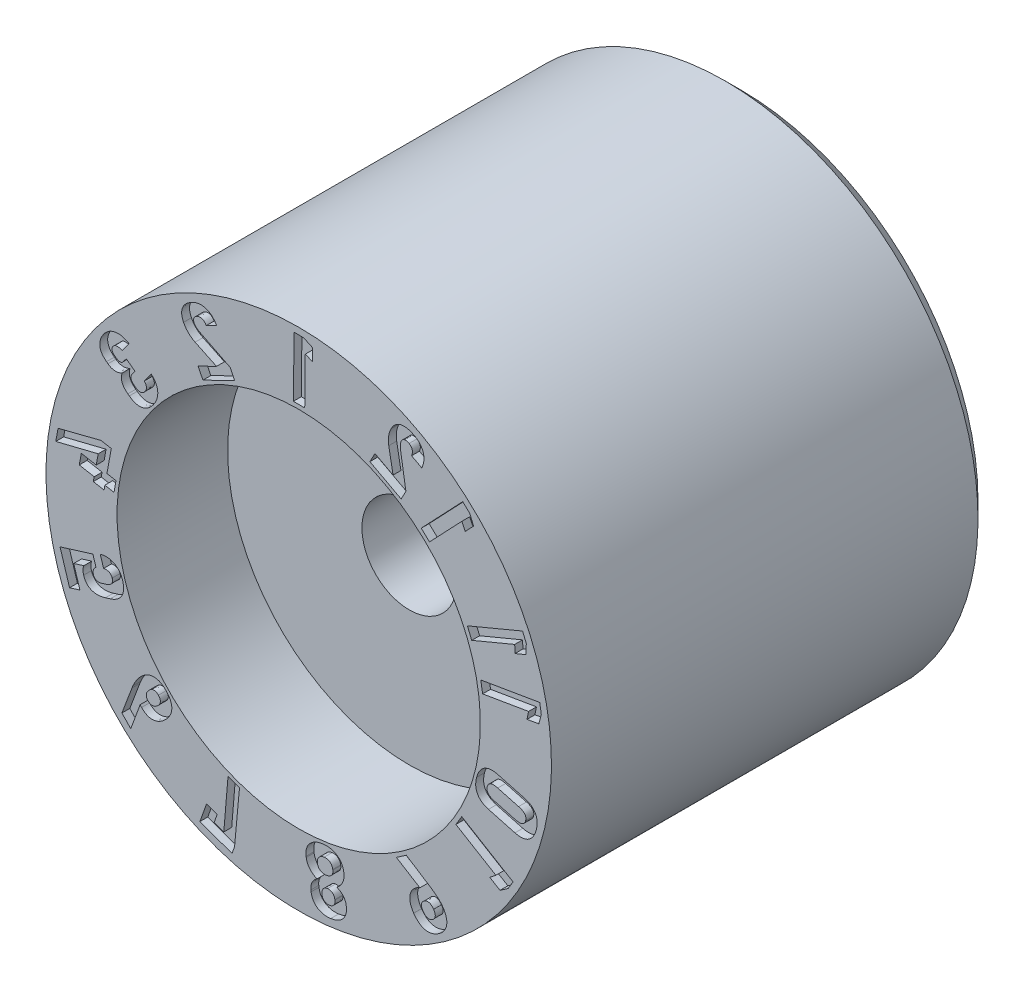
SolidWorks part; units mm, degrees
ref_plane "Front Plane" through (0, 0, 0) normal (0, 0, 1) x (1, 0, 0)
ref_plane "Top Plane" through (0, 0, 0) normal (0, 1, 0) x (1, 0, 0)
ref_plane "Right Plane" through (0, 0, 0) normal (1, 0, 0) x (0, 0, -1)
sketch "Sketch1" plane through (0, 0, 0) normal (-1, 0, 0) x (0, 0, 1)
  line L0 (0, 0) -> (75.4695, 0) construction
  line L2 (-14, -1.5) -> (-14, -7.5)
  line L4 (-13.5, -8) -> (0, -8)
  line L5 (0, -8) -> (0, -5.75)
  line L7 (0, -5.75) -> (-3.5, -5.75)
  line L8 (-3.5, -5.75) -> (-3.5, -1.5)
  line L9 (-3.5, -1.5) -> (-14, -1.5)
  line L12 (-14, -7.5) -> (-13.5, -8)
  point P6 (-14, -8)
  dimension "D1" = 14
  dimension "D2" = 16
  dimension "D3" = 11.5
  dimension "D4" = 3.5
  dimension "D5" = 3
revolve "Revolve1" add sketch "Sketch1" angle 360 about L0
sketch "Sketch2" plane through (0, 0, 0) normal (0, 0, 1) x (0, -1, 0)
  line L0 (-5.8852, -0.1684) -> (-5.8813, 0.1904)
  line L1 (-5.8813, 0.1904) -> (-7.3649, 0.207)
  line L2 (-7.3649, 0.207) -> (-7.2741, 0.4382)
  line L3 (-7.2741, 0.4382) -> (-7.6558, 0.4425)
  line L4 (-7.6558, 0.4425) -> (-7.7871, 0.1594)
  line L5 (-7.7871, 0.1594) -> (-7.7904, -0.1469)
  line L6 (-7.7904, -0.1469) -> (-5.8852, -0.1684)
  line L7 (-5.8129, -2.1676) -> (-6.2953, -3.126)
  line L8 (-6.4615, -3.3102) -> (-6.4641, -3.3111)
  line L9 (-6.5834, -2.9245) -> (-6.5824, -2.9238)
  line L10 (-6.5824, -2.9238) -> (-6.743, -2.5953)
  line L11 (-6.743, -2.5953) -> (-6.744, -2.596)
  line L12 (-6.3122, -3.6457) -> (-6.3112, -3.645)
  line L13 (-5.9497, -3.2788) -> (-5.6256, -2.6016)
  line L14 (-5.6256, -2.6016) -> (-5.3417, -3.1833)
  line L15 (-5.3417, -3.1833) -> (-5.0327, -3.0325)
  line L16 (-5.0327, -3.0325) -> (-5.524, -2.0266)
  line L17 (-5.524, -2.0266) -> (-5.8129, -2.1676)
  line L18 (-4.3769, -4.6673) -> (-4.0799, -4.8894)
  line L19 (-3.7679, -5.1641) -> (-3.7944, -5.1997)
  line L20 (-4.0701, -5.2769) -> (-4.1992, -5.1804)
  line L21 (-4.1992, -5.1804) -> (-4.4066, -5.4574)
  line L22 (-4.4066, -5.4574) -> (-4.2775, -5.5539)
  line L23 (-4.2807, -5.7973) -> (-4.3001, -5.8233)
  line L24 (-4.5665, -5.5903) -> (-4.8624, -5.369)
  line L25 (-4.0138, -6.0834) -> (-3.9793, -6.0372)
  line L26 (-3.4699, -5.4087) -> (-3.4353, -5.3625)
  line L27 (-1.7674, -6.2554) -> (-1.4221, -7.6169)
  line L28 (-1.4221, -7.6169) -> (-1.0242, -7.6897)
  line L29 (-1.0242, -7.6897) -> (-1.3566, -6.3465)
  line L30 (-1.3566, -6.3465) -> (-1.0162, -6.4089)
  line L31 (-0.5183, -6.5003) -> (-0.456, -6.1616)
  line L32 (-0.456, -6.1616) -> (-0.6022, -6.1348)
  line L33 (-1.708, -5.9321) -> (-1.7674, -6.2554)
  line L34 (-1.1029, -6.8816) -> (-0.7511, -6.9461)
  line L35 (-0.7511, -6.9461) -> (-0.6644, -6.4735)
  line L36 (-0.5494, -5.847) -> (-0.9012, -5.7826)
  line L37 (-0.9012, -5.7826) -> (-0.954, -6.0703)
  line L38 (1.3595, -6.2809) -> (1.3599, -6.2821)
  line L39 (1.3599, -6.2821) -> (1.7008, -6.1764)
  line L40 (1.7008, -6.1764) -> (1.7004, -6.1753)
  line L41 (2.0865, -6.0701) -> (2.1334, -6.2219)
  line L42 (1.794, -6.4162) -> (1.4756, -6.5149)
  line L43 (1.4756, -6.5149) -> (1.7978, -7.5544)
  line L44 (1.7978, -7.5544) -> (2.7693, -7.2535)
  line L45 (2.7693, -7.2535) -> (2.6674, -6.9253)
  line L46 (2.6674, -6.9253) -> (2.0368, -7.1206)
  line L47 (2.0368, -7.1206) -> (1.938, -6.8008)
  line L48 (2.4744, -6.1166) -> (2.4275, -5.9647)
  line L49 (4.0672, -4.99) -> (4.068, -4.9907)
  line L50 (4.528, -5.2774) -> (5.3733, -5.5969)
  line L51 (5.3733, -5.5969) -> (5.6639, -5.3158)
  line L52 (5.6639, -5.3158) -> (4.8545, -5.0182)
  line L54 (4.8709, -4.2237) -> (4.8697, -4.2225)
  line L55 (4.5971, -4.4553) -> (4.5983, -4.4565)
  line L56 (4.313, -4.7302) -> (4.3122, -4.7294)
  line L57 (7.2565, -2.031) -> (5.5551, -1.8735)
  line L58 (5.5551, -1.8735) -> (5.4252, -2.2375)
  line L59 (5.4252, -2.2375) -> (7.0216, -2.3711)
  line L60 (7.0216, -2.3711) -> (6.9122, -2.6771)
  line L61 (6.9122, -2.6771) -> (6.6439, -2.5811)
  line L62 (6.6439, -2.5811) -> (6.5241, -2.917)
  line L63 (6.5241, -2.917) -> (7.116, -3.1286)
  line L64 (7.116, -3.1286) -> (7.4797, -2.1106)
  line L65 (7.4797, -2.1106) -> (7.2565, -2.031)
  line L66 (6.3837, 0.2337) -> (6.4146, 0.2376)
  line L67 (7.2319, 0.385) -> (7.2812, 0.3913)
  line L68 (7.1342, 1.5064) -> (7.0849, 1.5001)
  line L69 (6.2572, 1.4299) -> (6.2263, 1.426)
  line L70 (6.3248, 1.0781) -> (6.3427, 1.0807)
  line L71 (6.4052, 0.5969) -> (6.3856, 0.5946)
  line L72 (7.1171, 1.1433) -> (7.1354, 1.146)
  line L73 (7.1874, 0.7395) -> (7.1682, 0.7373)
  line L75 (6.2418, 3.6387) -> (6.2433, 3.6395)
  line L76 (5.6038, 4.5563) -> (5.6023, 4.5556)
  line L77 (5.251, 4.1507) -> (4.7713, 3.4049)
  line L78 (4.7713, 3.4049) -> (4.9874, 3.0914)
  line L79 (4.9874, 3.0914) -> (5.4482, 3.8353)
  line L80 (5.8208, 4.2686) -> (5.8219, 4.2694)
  line L81 (6.0466, 3.941) -> (6.0455, 3.9401)
  line L82 (2.8354, 5.1597) -> (3.1417, 4.9756)
  line L83 (3.1417, 4.9756) -> (3.9023, 6.2398)
  line L84 (3.9023, 6.2398) -> (4.0547, 6.0458)
  line L85 (4.0547, 6.0458) -> (4.2501, 6.371)
  line L86 (4.2501, 6.371) -> (4.0738, 6.626)
  line L87 (4.0738, 6.626) -> (3.8125, 6.7833)
  line L88 (3.8125, 6.7833) -> (2.8354, 5.1597)
  line L89 (2.2124, 6.0064) -> (2.4386, 6.8437)
  line L90 (1.3369, 7.1415) -> (1.1107, 6.3043)
  line L91 (1.4817, 6.2993) -> (1.6602, 6.9591)
  line L92 (2.0679, 6.8485) -> (1.8895, 6.1887)
  line L93 (-1.2115, 5.7613) -> (-0.8595, 5.8212)
  line L94 (-0.8595, 5.8212) -> (-1.1058, 7.2741)
  line L95 (-1.1058, 7.2741) -> (-0.8644, 7.2268)
  line L96 (-0.8644, 7.2268) -> (-0.9278, 7.5999)
  line L97 (-0.9278, 7.5999) -> (-1.2279, 7.6789)
  line L98 (-1.2279, 7.6789) -> (-1.5282, 7.6276)
  line L99 (-1.5282, 7.6276) -> (-1.2115, 5.7613)
  line L100 (-2.4833, 5.3383) -> (-2.1544, 5.476)
  line L101 (-2.1544, 5.476) -> (-2.7229, 6.8365)
  line L102 (-2.7229, 6.8365) -> (-2.4763, 6.8448)
  line L103 (-2.4763, 6.8448) -> (-2.6226, 7.1943)
  line L104 (-2.6226, 7.1943) -> (-2.9328, 7.2031)
  line L105 (-2.9328, 7.2031) -> (-3.2138, 7.0855)
  line L106 (-3.2138, 7.0855) -> (-2.4833, 5.3383)
  line L107 (-4.4306, 3.8778) -> (-4.1829, 4.1388)
  line L108 (-4.1829, 4.1388) -> (-5.2607, 5.1622)
  line L109 (-5.2607, 5.1622) -> (-5.0369, 5.2705)
  line L110 (-5.0369, 5.2705) -> (-5.3141, 5.5334)
  line L111 (-5.3141, 5.5334) -> (-5.6036, 5.415)
  line L112 (-5.6036, 5.415) -> (-5.8151, 5.1922)
  line L113 (-5.8151, 5.1922) -> (-4.4306, 3.8778)
  line L114 (-5.1966, 3.3926) -> (-6.2573, 3.2208)
  line L115 (-6.5045, 3.2475) -> (-6.5068, 3.2487)
  line L116 (-6.2632, 3.5728) -> (-6.2623, 3.5721)
  line L117 (-6.2623, 3.5721) -> (-6.0898, 3.8952)
  line L118 (-6.0898, 3.8952) -> (-6.0908, 3.8959)
  line L119 (-6.6889, 2.9293) -> (-6.6876, 2.9288)
  line L120 (-6.1782, 2.8506) -> (-5.4387, 2.9854)
  line L121 (-5.4387, 2.9854) -> (-5.7435, 2.4136)
  line L122 (-5.7435, 2.4136) -> (-5.4397, 2.2518)
  line L123 (-5.4397, 2.2518) -> (-4.9123, 3.2412)
  line L124 (-4.9123, 3.2412) -> (-5.1966, 3.3926)
  line L125 (-1.0162, -6.4089) -> (-1.1029, -6.8816)
  line L126 (-0.6022, -6.1348) -> (-0.5494, -5.847)
  line L127 (-0.6644, -6.4735) -> (-0.5183, -6.5003)
  line L128 (-0.954, -6.0703) -> (-1.708, -5.9321)
  circle A0 centre (0, 0) radius 5.9 construction
  spline S0 degree 3 poles (-6.2953, -3.126) (-6.3152, -3.1668) (-6.3464, -3.2142) (-6.3924, -3.2615) (-6.4218, -3.2867) (-6.4453, -3.302) (-6.4615, -3.3102) knots 0 0 0 0 0.540924 0.666719 0.78521 1 1 1 1
  spline S1 degree 3 poles (-6.4641, -3.3111) (-6.4847, -3.3216) (-6.5178, -3.3314) (-6.5623, -3.3294) (-6.5931, -3.3197) (-6.6217, -3.3023) (-6.6593, -3.269) (-6.6789, -3.2343) (-6.6913, -3.2103) knots 0 0 0 0 0.246374 0.357484 0.468975 0.586096 0.710177 1 1 1 1
  spline S2 degree 3 poles (-6.6913, -3.2103) (-6.7032, -3.186) (-6.7153, -3.1471) (-6.7135, -3.0939) (-6.7028, -3.0558) (-6.6849, -3.019) (-6.6481, -2.971) (-6.6106, -2.9421) (-6.5834, -2.9245) knots 0 0 0 0 0.239492 0.352314 0.467332 0.58681 0.712523 1 1 1 1
  spline S3 degree 3 poles (-6.744, -2.596) (-6.7923, -2.6236) (-6.8595, -2.6705) (-6.9348, -2.7456) (-6.9806, -2.8046) (-7.0174, -2.8669) (-7.0446, -2.9321) (-7.0619, -3) (-7.0694, -3.0701) (-7.0669, -3.1417) (-7.0515, -3.2407) (-7.0234, -3.3123) (-7.0012, -3.359) knots 0 0 0 0 0.185501 0.271338 0.35402 0.434025 0.511907 0.588797 0.66669 0.746156 0.827115 1 1 1 1
  spline S4 degree 3 poles (-7.0012, -3.359) (-6.977, -3.4084) (-6.9364, -3.4779) (-6.8701, -3.5577) (-6.8181, -3.6062) (-6.763, -3.6453) (-6.7054, -3.6758) (-6.6441, -3.6949) (-6.5809, -3.7055) (-6.5153, -3.7055) (-6.4234, -3.6916) (-6.3559, -3.6674) (-6.3122, -3.6457) knots 0 0 0 0 0.19475 0.283309 0.366633 0.445697 0.521961 0.59653 0.67174 0.748345 0.827521 1 1 1 1
  spline S5 degree 3 poles (-6.3112, -3.645) (-6.2724, -3.6266) (-6.2171, -3.5924) (-6.1485, -3.5387) (-6.1004, -3.4929) (-6.0554, -3.4441) (-6.0027, -3.374) (-5.9681, -3.3183) (-5.9497, -3.2788) knots 0 0 0 0 0.245976 0.371149 0.498271 0.62543 0.751106 1 1 1 1
  spline S6 degree 3 poles (-3.5683, -4.6062) (-3.6119, -4.5727) (-3.6815, -4.5314) (-3.779, -4.4903) (-3.8517, -4.4705) (-3.9242, -4.4601) (-3.9959, -4.4598) (-4.0665, -4.4693) (-4.1357, -4.4886) (-4.2023, -4.5183) (-4.2884, -4.5722) (-4.3435, -4.6272) (-4.3769, -4.6673) knots 0 0 0 0 0.181569 0.26678 0.349602 0.430041 0.508529 0.586128 0.665195 0.745151 0.826793 1 1 1 1
  spline S7 degree 3 poles (-4.0799, -4.8894) (-4.0669, -4.8761) (-4.0461, -4.8582) (-4.0157, -4.8394) (-3.9928, -4.8294) (-3.9696, -4.8224) (-3.9462, -4.8188) (-3.9227, -4.8178) (-3.8992, -4.8202) (-3.8758, -4.8259) (-3.8445, -4.8381) (-3.8224, -4.8513) (-3.8084, -4.8619) knots 0 0 0 0 0.185322 0.271186 0.353768 0.433306 0.511129 0.588304 0.666454 0.745868 0.826198 1 1 1 1
  spline S8 degree 3 poles (-3.8084, -4.8619) (-3.7838, -4.8799) (-3.7516, -4.9115) (-3.7246, -4.9627) (-3.7148, -5.002) (-3.7139, -5.0425) (-3.7266, -5.0997) (-3.7494, -5.1392) (-3.7679, -5.1641) knots 0 0 0 0 0.264916 0.382863 0.497044 0.612324 0.730419 1 1 1 1
  spline S9 degree 3 poles (-3.7944, -5.1997) (-3.8143, -5.2251) (-3.8448, -5.2612) (-3.8947, -5.2932) (-3.9304, -5.3084) (-3.9667, -5.3139) (-4.0162, -5.3106) (-4.0498, -5.2915) (-4.0701, -5.2769) knots 0 0 0 0 0.301108 0.428623 0.546089 0.657263 0.765523 1 1 1 1
  spline S10 degree 3 poles (-4.2775, -5.5539) (-4.2606, -5.5659) (-4.2395, -5.5894) (-4.2256, -5.6281) (-4.2227, -5.6593) (-4.2267, -5.6923) (-4.2429, -5.7407) (-4.2637, -5.7751) (-4.2807, -5.7973) knots 0 0 0 0 0.226456 0.333734 0.444659 0.565242 0.694774 1 1 1 1
  spline S11 degree 3 poles (-4.3001, -5.8233) (-4.316, -5.844) (-4.3415, -5.8728) (-4.3832, -5.8977) (-4.4139, -5.9084) (-4.4453, -5.9117) (-4.4886, -5.906) (-4.5184, -5.8898) (-4.5363, -5.8763) knots 0 0 0 0 0.287243 0.411792 0.527495 0.639812 0.753407 1 1 1 1
  spline S12 degree 3 poles (-4.5363, -5.8763) (-4.5486, -5.8667) (-4.5659, -5.8506) (-4.5829, -5.8244) (-4.5928, -5.8032) (-4.6, -5.7804) (-4.6042, -5.7564) (-4.6057, -5.7311) (-4.6037, -5.7045) (-4.599, -5.677) (-4.5879, -5.6382) (-4.5763, -5.6093) (-4.5665, -5.5903) knots 0 0 0 0 0.149751 0.222736 0.297358 0.372558 0.449625 0.529756 0.614461 0.703231 0.795895 1 1 1 1
  spline S13 degree 3 poles (-4.8624, -5.369) (-4.8911, -5.416) (-4.9278, -5.4887) (-4.9572, -5.5906) (-4.9688, -5.6648) (-4.9713, -5.7378) (-4.9635, -5.8089) (-4.947, -5.8776) (-4.9206, -5.9432) (-4.8866, -6.0056) (-4.8283, -6.0834) (-4.7748, -6.1342) (-4.7348, -6.1635) knots 0 0 0 0 0.185347 0.27176 0.355595 0.437386 0.516616 0.59533 0.674074 0.753729 0.833597 1 1 1 1
  spline S14 degree 3 poles (-4.7348, -6.1635) (-4.7029, -6.1875) (-4.6539, -6.2194) (-4.5859, -6.2533) (-4.5367, -6.2726) (-4.4879, -6.2861) (-4.4395, -6.2949) (-4.3914, -6.2974) (-4.344, -6.2952) (-4.2974, -6.2876) (-4.2524, -6.2739) (-4.2085, -6.2558) (-4.1665, -6.2317) (-4.1258, -6.2025) (-4.072, -6.1553) (-4.0365, -6.1132) (-4.0138, -6.0834) knots 0 0 0 0 0.145015 0.212027 0.275759 0.336776 0.395938 0.454132 0.511359 0.568209 0.624973 0.681963 0.740474 0.800697 0.863707 1 1 1 1
  spline S15 degree 3 poles (-3.9793, -6.0372) (-3.9543, -6.0039) (-3.9232, -5.9499) (-3.9007, -5.8716) (-3.8929, -5.8127) (-3.895, -5.7534) (-3.911, -5.6733) (-3.9367, -5.6164) (-3.9588, -5.5808) knots 0 0 0 0 0.256338 0.378395 0.499234 0.620463 0.74196 1 1 1 1
  spline S16 degree 3 poles (-3.9588, -5.5808) (-3.9382, -5.5906) (-3.9061, -5.6014) (-3.8624, -5.61) (-3.8302, -5.6136) (-3.798, -5.613) (-3.7657, -5.6098) (-3.7335, -5.6033) (-3.6905, -5.5903) (-3.6377, -5.5656) (-3.554, -5.5098) (-3.5024, -5.4506) (-3.4699, -5.4087) knots 0 0 0 0 0.120784 0.179432 0.236283 0.292935 0.350396 0.408362 0.467375 0.589077 0.716316 1 1 1 1
  spline S17 degree 3 poles (-3.4353, -5.3625) (-3.4049, -5.3206) (-3.3638, -5.2562) (-3.33, -5.1633) (-3.3155, -5.0959) (-3.3116, -5.0291) (-3.3173, -4.9631) (-3.3344, -4.8983) (-3.3615, -4.8349) (-3.3986, -4.7733) (-3.4642, -4.6926) (-3.524, -4.6388) (-3.5683, -4.6062) knots 0 0 0 0 0.178322 0.259914 0.338341 0.414267 0.48915 0.565077 0.643479 0.725106 0.811155 1 1 1 1
  spline S18 degree 3 poles (1.722, -5.5757) (1.6758, -5.5903) (1.6088, -5.6185) (1.5303, -5.6726) (1.4787, -5.7194) (1.4342, -5.7722) (1.398, -5.8314) (1.3689, -5.8956) (1.3491, -5.9654) (1.338, -6.0395) (1.3351, -6.1459) (1.3469, -6.2269) (1.3595, -6.2809) knots 0 0 0 0 0.164951 0.244387 0.322686 0.400848 0.478265 0.557501 0.639295 0.723925 0.811483 1 1 1 1
  spline S19 degree 3 poles (1.7004, -6.1753) (1.6936, -6.1442) (1.6897, -6.0981) (1.698, -6.0392) (1.7117, -6.0012) (1.7318, -5.9677) (1.7686, -5.9304) (1.804, -5.9118) (1.8296, -5.9044) knots 0 0 0 0 0.286251 0.41197 0.532179 0.648041 0.760757 1 1 1 1
  spline S20 degree 3 poles (1.8296, -5.9044) (1.8566, -5.8959) (1.8985, -5.8899) (1.952, -5.9014) (1.9873, -5.9194) (2.0189, -5.9456) (2.058, -5.9933) (2.0762, -6.0385) (2.0865, -6.0701) knots 0 0 0 0 0.245943 0.357035 0.469046 0.586207 0.710397 1 1 1 1
  spline S21 degree 3 poles (2.1334, -6.2219) (2.1432, -6.2536) (2.1536, -6.3007) (2.1512, -6.3615) (2.1417, -6.4001) (2.1255, -6.4339) (2.0928, -6.4717) (2.0589, -6.4897) (2.0346, -6.4968) knots 0 0 0 0 0.302868 0.431901 0.550443 0.661671 0.769584 1 1 1 1
  spline S22 degree 3 poles (2.0346, -6.4968) (2.0117, -6.5037) (1.9767, -6.5104) (1.9303, -6.5068) (1.8978, -6.499) (1.8675, -6.4857) (1.8299, -6.4608) (1.8066, -6.4354) (1.794, -6.4162) knots 0 0 0 0 0.262338 0.385718 0.507592 0.627408 0.74745 1 1 1 1
  spline S23 degree 3 poles (1.938, -6.8008) (1.9557, -6.8093) (1.9848, -6.8195) (2.0268, -6.8258) (2.0615, -6.828) (2.0973, -6.8268) (2.1443, -6.8229) (2.1785, -6.8148) (2.2005, -6.8082) knots 0 0 0 0 0.220181 0.34169 0.473688 0.609114 0.742087 1 1 1 1
  spline S24 degree 3 poles (2.2005, -6.8082) (2.2442, -6.7944) (2.307, -6.7679) (2.378, -6.715) (2.4221, -6.67) (2.4586, -6.619) (2.4865, -6.562) (2.5057, -6.4993) (2.5165, -6.4314) (2.5186, -6.3587) (2.511, -6.2518) (2.4909, -6.1711) (2.4744, -6.1166) knots 0 0 0 0 0.163581 0.239383 0.313638 0.387163 0.461531 0.538643 0.619556 0.705725 0.79695 1 1 1 1
  spline S25 degree 3 poles (2.4275, -5.9647) (2.4107, -5.9103) (2.3795, -5.8326) (2.3216, -5.7412) (2.2735, -5.6839) (2.2202, -5.6357) (2.1617, -5.597) (2.0982, -5.5685) (2.0302, -5.5495) (1.9578, -5.5406) (1.8534, -5.5424) (1.7744, -5.5593) (1.722, -5.5757) knots 0 0 0 0 0.186924 0.272225 0.353505 0.431383 0.507079 0.582002 0.658711 0.737653 0.81986 1 1 1 1
  spline S26 degree 3 poles (4.0675, -4.1929) (4.0284, -4.2308) (3.976, -4.2913) (3.924, -4.3809) (3.8974, -4.448) (3.8809, -4.5161) (3.8757, -4.585) (3.8811, -4.6541) (3.897, -4.7234) (3.924, -4.7921) (3.9757, -4.8855) (4.0278, -4.9496) (4.0672, -4.99) knots 0 0 0 0 0.180435 0.26266 0.341945 0.418745 0.493877 0.569633 0.647322 0.728297 0.813161 1 1 1 1
  spline S27 degree 3 poles (4.068, -4.9907) (4.0926, -5.0161) (4.1326, -5.0524) (4.1904, -5.0976) (4.288, -5.1652) (4.3765, -5.2129) (4.4503, -5.2456) knots 0 0 0 0 0.229425 0.350331 0.475684 1 1 1 1
  spline S28 degree 3 poles (4.4503, -5.2456) (4.4634, -5.2511) (4.4888, -5.263) (4.5151, -5.2728) (4.528, -5.2774) knots 0 0 0 0 0.507579 1 1 1 1
  spline S29 degree 3 poles (4.8545, -5.0182) (4.8741, -5.0056) (4.8922, -4.9908) (4.9089, -4.9746) knots 0.758085 0.758085 0.758085 0.758085 1 1 1 1
  spline S30 degree 3 poles (4.9089, -4.9746) (4.9442, -4.9409) (4.9898, -4.8856) (5.0347, -4.8038) (5.0562, -4.7417) (5.0686, -4.6781) (5.0697, -4.6135) (5.0613, -4.5481) (5.0425, -4.4824) (5.0142, -4.4164) (4.9617, -4.3257) (4.9092, -4.2638) (4.8709, -4.2237) knots 0 0 0 0 0.171552 0.250176 0.326702 0.401809 0.476743 0.552956 0.632633 0.716301 0.80484 1 1 1 1
  spline S31 degree 3 poles (4.8697, -4.2225) (4.8307, -4.1811) (4.7674, -4.1271) (4.6753, -4.0712) (4.6066, -4.0419) (4.5374, -4.0227) (4.4679, -4.0147) (4.3985, -4.017) (4.3295, -4.0314) (4.2614, -4.0558) (4.1694, -4.1043) (4.1069, -4.1549) (4.0675, -4.1929) knots 0 0 0 0 0.18695 0.271963 0.353439 0.431722 0.507098 0.582642 0.658968 0.737738 0.81972 1 1 1 1
  spline S32 degree 3 poles (4.3071, -4.4406) (4.3273, -4.4203) (4.3616, -4.3958) (4.4132, -4.3792) (4.4513, -4.3771) (4.4895, -4.3836) (4.5421, -4.4047) (4.576, -4.4338) (4.5971, -4.4553) knots 0 0 0 0 0.260089 0.374783 0.488634 0.603178 0.72406 1 1 1 1
  spline S33 degree 3 poles (4.5983, -4.4565) (4.6224, -4.4816) (4.6545, -4.5208) (4.6793, -4.5798) (4.688, -4.6211) (4.6869, -4.6617) (4.672, -4.7153) (4.6455, -4.7496) (4.6251, -4.7696) knots 0 0 0 0 0.294173 0.419085 0.536109 0.647083 0.757101 1 1 1 1
  spline S34 degree 3 poles (4.6251, -4.7696) (4.6047, -4.7891) (4.5697, -4.8142) (4.5155, -4.8264) (4.4746, -4.8261) (4.4334, -4.8155) (4.3753, -4.7882) (4.3374, -4.7547) (4.313, -4.7302) knots 0 0 0 0 0.239607 0.350713 0.462757 0.580918 0.706868 1 1 1 1
  spline S35 degree 3 poles (4.3122, -4.7294) (4.2916, -4.7073) (4.2635, -4.6726) (4.2441, -4.6194) (4.2387, -4.5813) (4.2428, -4.5435) (4.2606, -4.4928) (4.2868, -4.4601) (4.3071, -4.4406) knots 0 0 0 0 0.27769 0.398449 0.513506 0.626362 0.741961 1 1 1 1
  spline S36 degree 3 poles (5.7823, 0.7607) (5.7894, 0.7045) (5.8077, 0.623) (5.8491, 0.5224) (5.8865, 0.4557) (5.9305, 0.3963) (5.9809, 0.3455) (6.0369, 0.3028) (6.0986, 0.2695) (6.1646, 0.2449) (6.26, 0.2259) (6.3342, 0.2272) (6.3837, 0.2337) knots 0 0 0 0 0.18897 0.276572 0.3617 0.443462 0.521959 0.59953 0.67713 0.754933 0.833533 1 1 1 1
  spline S37 degree 3 poles (6.4146, 0.2376) (6.461, 0.2429) (6.5286, 0.2631) (6.6125, 0.3064) (6.6706, 0.3488) (6.7232, 0.3979) (6.7821, 0.473) (6.815, 0.5366) (6.8295, 0.5819) knots 0 0 0 0 0.245874 0.369723 0.497261 0.62485 0.749381 1 1 1 1
  spline S38 degree 3 poles (6.8295, 0.5819) (6.8516, 0.548) (6.8917, 0.5021) (6.9556, 0.4529) (7.0076, 0.4228) (7.0621, 0.3998) (7.1369, 0.3815) (7.1943, 0.3794) (7.2319, 0.385) knots 0 0 0 0 0.257462 0.383888 0.511837 0.638239 0.759243 1 1 1 1
  spline S39 degree 3 poles (7.2812, 0.3913) (7.3279, 0.397) (7.3955, 0.4147) (7.4778, 0.4551) (7.5322, 0.4932) (7.58, 0.5388) (7.6213, 0.5907) (7.6544, 0.6494) (7.6806, 0.7135) (7.6989, 0.7828) (7.7115, 0.8836) (7.7088, 0.9616) (7.7015, 1.0142) knots 0 0 0 0 0.16692 0.245622 0.324152 0.401797 0.479414 0.558535 0.640111 0.724597 0.811872 1 1 1 1
  spline S40 degree 3 poles (7.7015, 1.0142) (7.694, 1.0664) (7.678, 1.143) (7.6384, 1.2365) (7.6035, 1.2991) (7.5612, 1.354) (7.5141, 1.4019) (7.461, 1.4413) (7.4032, 1.4727) (7.3405, 1.4951) (7.2508, 1.5141) (7.1807, 1.5124) (7.1342, 1.5064) knots 0 0 0 0 0.18794 0.275344 0.360031 0.441653 0.520786 0.597734 0.675552 0.75395 0.83321 1 1 1 1
  spline S41 degree 3 poles (7.0849, 1.5001) (7.0468, 1.4953) (6.9911, 1.4785) (6.9231, 1.4408) (6.8766, 1.4035) (6.8339, 1.3609) (6.7861, 1.2953) (6.7596, 1.2402) (6.7478, 1.2011) knots 0 0 0 0 0.242029 0.363319 0.489116 0.616671 0.742842 1 1 1 1
  spline S42 degree 3 poles (6.7478, 1.2011) (6.7206, 1.2404) (6.6739, 1.2959) (6.596, 1.3522) (6.5329, 1.3874) (6.4657, 1.4131) (6.3741, 1.4358) (6.3032, 1.4354) (6.2572, 1.4299) knots 0 0 0 0 0.252401 0.377134 0.504621 0.631739 0.755354 1 1 1 1
  spline S43 degree 3 poles (6.2263, 1.426) (6.1768, 1.4196) (6.105, 1.401) (6.0177, 1.3581) (5.9605, 1.3171) (5.9094, 1.2692) (5.8665, 1.2136) (5.8311, 1.1512) (5.8041, 1.0825) (5.7849, 1.0083) (5.7708, 0.9005) (5.7754, 0.817) (5.7823, 0.7607) knots 0 0 0 0 0.166281 0.24502 0.322997 0.400172 0.477621 0.5562 0.638393 0.723135 0.810892 1 1 1 1
  spline S44 degree 3 poles (6.1239, 0.8059) (6.1205, 0.8284) (6.1201, 0.8621) (6.1269, 0.9056) (6.1359, 0.9358) (6.1481, 0.9641) (6.1647, 0.9895) (6.1843, 1.0124) (6.2072, 1.0325) (6.2331, 1.0493) (6.2713, 1.0683) (6.3032, 1.0749) (6.3248, 1.0781) knots 0 0 0 0 0.179137 0.263849 0.346611 0.427375 0.506262 0.584852 0.66468 0.745956 0.827181 1 1 1 1
  spline S45 degree 3 poles (6.3427, 1.0807) (6.3628, 1.084) (6.3929, 1.0834) (6.4317, 1.0759) (6.4583, 1.0654) (6.4834, 1.0521) (6.5057, 1.0344) (6.5265, 1.0142) (6.5443, 0.9902) (6.5595, 0.9633) (6.5767, 0.9228) (6.5836, 0.8896) (6.5869, 0.867) knots 0 0 0 0 0.166691 0.246113 0.323892 0.401265 0.478433 0.557271 0.639209 0.723761 0.811153 1 1 1 1
  spline S46 degree 3 poles (6.5869, 0.867) (6.5898, 0.8443) (6.5914, 0.8105) (6.5857, 0.7669) (6.5779, 0.7368) (6.5665, 0.7091) (6.5522, 0.6837) (6.5344, 0.6611) (6.5136, 0.6413) (6.49, 0.6245) (6.4544, 0.6071) (6.4253, 0.5993) (6.4052, 0.5969) knots 0 0 0 0 0.18743 0.275451 0.359684 0.44151 0.520155 0.597919 0.676479 0.755124 0.834279 1 1 1 1
  spline S47 degree 3 poles (6.3856, 0.5946) (6.364, 0.5911) (6.3318, 0.5914) (6.29, 0.5981) (6.2611, 0.608) (6.2342, 0.6219) (6.2094, 0.6386) (6.1875, 0.6593) (6.1682, 0.6832) (6.1523, 0.7103) (6.134, 0.7504) (6.1269, 0.7835) (6.1239, 0.8059) knots 0 0 0 0 0.172867 0.253862 0.334268 0.413836 0.492611 0.570906 0.651844 0.734729 0.820133 1 1 1 1
  spline S48 degree 3 poles (6.9308, 0.9125) (6.9281, 0.9316) (6.9274, 0.9604) (6.9343, 0.9972) (6.9431, 1.0225) (6.9541, 1.0465) (6.9697, 1.0676) (6.9874, 1.0873) (7.0089, 1.1037) (7.0323, 1.1185) (7.0682, 1.1337) (7.0969, 1.1412) (7.1171, 1.1433) knots 0 0 0 0 0.173858 0.255854 0.335402 0.414135 0.49206 0.570451 0.650798 0.734329 0.818213 1 1 1 1
  spline S49 degree 3 poles (7.1354, 1.146) (7.1541, 1.1481) (7.1823, 1.1497) (7.2181, 1.1424) (7.243, 1.135) (7.266, 1.1238) (7.287, 1.1098) (7.3057, 1.0926) (7.3223, 1.0729) (7.3362, 1.0503) (7.351, 1.0161) (7.358, 0.9883) (7.3603, 0.9691) knots 0 0 0 0 0.176373 0.2587 0.339762 0.417994 0.495919 0.573464 0.653837 0.735486 0.820065 1 1 1 1
  spline S50 degree 3 poles (7.3603, 0.9691) (7.363, 0.95) (7.3636, 0.9214) (7.3581, 0.8845) (7.3503, 0.859) (7.3397, 0.8354) (7.3255, 0.8141) (7.3091, 0.7946) (7.2892, 0.778) (7.2671, 0.7639) (7.2336, 0.7487) (7.2065, 0.7415) (7.1874, 0.7395) knots 0 0 0 0 0.178886 0.263392 0.345004 0.424567 0.502825 0.581174 0.660014 0.741521 0.823405 1 1 1 1
  spline S51 degree 3 poles (7.1682, 0.7373) (7.1485, 0.7344) (7.1193, 0.7339) (7.0814, 0.7393) (7.0553, 0.7472) (7.0308, 0.758) (7.0083, 0.7718) (6.9884, 0.7889) (6.9708, 0.8086) (6.9562, 0.8312) (6.9402, 0.8652) (6.9331, 0.8932) (6.9308, 0.9125) knots 0 0 0 0 0.179228 0.26266 0.34481 0.424891 0.504315 0.582306 0.661155 0.742047 0.824338 1 1 1 1
  spline S52 degree 3 poles (5.4482, 3.8353) (5.4488, 3.8334) (5.4533, 3.8192) (5.4689, 3.7788) (5.4902, 3.7432) (5.5061, 3.7198) knots 0.562908 0.562908 0.562908 0.562908 0.582426 0.713304 1 1 1 1
  spline S53 degree 3 poles (5.5061, 3.7198) (5.5322, 3.6823) (5.577, 3.6309) (5.6493, 3.5785) (5.7072, 3.5491) (5.7684, 3.5281) (5.8324, 3.5161) (5.899, 3.5139) (5.9674, 3.5205) (6.0367, 3.5362) (6.1316, 3.5702) (6.1984, 3.6094) (6.2418, 3.6387) knots 0 0 0 0 0.164733 0.243043 0.320867 0.398148 0.47557 0.554854 0.637426 0.722765 0.810744 1 1 1 1
  spline S54 degree 3 poles (6.2433, 3.6395) (6.2907, 3.6719) (6.3556, 3.7258) (6.4265, 3.8084) (6.4676, 3.8715) (6.4977, 3.937) (6.5176, 4.0046) (6.5262, 4.074) (6.5243, 4.1448) (6.511, 4.2166) (6.478, 4.3161) (6.4379, 4.3865) (6.4069, 4.432) knots 0 0 0 0 0.18747 0.273143 0.354214 0.432215 0.507589 0.582962 0.659242 0.737954 0.82021 1 1 1 1
  spline S55 degree 3 poles (6.4069, 4.432) (6.3765, 4.4778) (6.3236, 4.5382) (6.2431, 4.6048) (6.1799, 4.6415) (6.1142, 4.669) (6.0455, 4.6844) (5.9749, 4.6905) (5.9023, 4.6846) (5.8282, 4.6689) (5.725, 4.6315) (5.6516, 4.589) (5.6038, 4.5563) knots 0 0 0 0 0.178235 0.259637 0.338302 0.414869 0.490216 0.566018 0.6443 0.726036 0.811611 1 1 1 1
  spline S56 degree 3 poles (5.6023, 4.5556) (5.5751, 4.5362) (5.5349, 4.5046) (5.4849, 4.4561) (5.4469, 4.4152) (5.4091, 4.3703) (5.3568, 4.3043) (5.319, 4.2518) (5.2941, 4.2154) knots 0 0 0 0 0.216736 0.331978 0.452461 0.579604 0.713156 1 1 1 1
  spline S57 degree 3 poles (5.2941, 4.2154) (5.287, 4.2044) (5.2718, 4.1834) (5.2576, 4.1617) (5.251, 4.1507) knots 0 0 0 0 0.504424 1 1 1 1
  spline S58 degree 3 poles (5.7404, 3.9727) (5.7243, 3.996) (5.7053, 4.0343) (5.7005, 4.0892) (5.7067, 4.1287) (5.7223, 4.1669) (5.7557, 4.2187) (5.794, 4.2491) (5.8208, 4.2686) knots 0 0 0 0 0.245772 0.358139 0.47098 0.587124 0.711724 1 1 1 1
  spline S59 degree 3 poles (5.8219, 4.2694) (5.8482, 4.2879) (5.8896, 4.3096) (5.9477, 4.3229) (5.988, 4.3225) (6.026, 4.3132) (6.0745, 4.2882) (6.1032, 4.2571) (6.1191, 4.2337) knots 0 0 0 0 0.283656 0.407176 0.522865 0.635948 0.74909 1 1 1 1
  spline S60 degree 3 poles (6.1191, 4.2337) (6.1357, 4.21) (6.1546, 4.1715) (6.1612, 4.1166) (6.1559, 4.0775) (6.1416, 4.0397) (6.1085, 3.9898) (6.0734, 3.9589) (6.0466, 3.941) knots 0 0 0 0 0.253962 0.366762 0.479369 0.595911 0.717631 1 1 1 1
  spline S61 degree 3 poles (6.0455, 3.9401) (6.0177, 3.9223) (5.976, 3.8972) (5.9159, 3.8845) (5.8748, 3.8836) (5.8357, 3.8924) (5.7859, 3.9172) (5.7566, 3.9489) (5.7404, 3.9727) knots 0 0 0 0 0.286688 0.409654 0.525636 0.638334 0.750719 1 1 1 1
  spline S62 degree 3 poles (1.52, 5.6325) (1.5624, 5.6205) (1.6254, 5.6083) (1.7085, 5.601) (1.7661, 5.6021) (1.8209, 5.6076) (1.8728, 5.6198) (1.9219, 5.6368) (1.9681, 5.6594) (2.0109, 5.687) (2.0505, 5.7191) (2.0863, 5.756) (2.1189, 5.7973) (2.1481, 5.8428) (2.1825, 5.9117) (2.2022, 5.9674) (2.2124, 6.0064) knots 0 0 0 0 0.147191 0.214626 0.278833 0.339979 0.39887 0.456662 0.513809 0.570752 0.62689 0.68432 0.742478 0.802827 0.865077 1 1 1 1
  spline S63 degree 3 poles (2.4386, 6.8437) (2.4491, 6.8828) (2.4604, 6.9413) (2.4662, 7.0187) (2.4639, 7.0731) (2.4565, 7.1252) (2.4443, 7.175) (2.426, 7.2225) (2.4027, 7.2678) (2.3737, 7.31) (2.3399, 7.3495) (2.301, 7.3857) (2.2563, 7.4179) (2.2072, 7.4478) (2.1321, 7.4835) (2.0716, 7.5043) (2.0293, 7.5155) knots 0 0 0 0 0.135734 0.198831 0.259399 0.317671 0.374624 0.430931 0.487646 0.544689 0.602065 0.661305 0.72212 0.786221 0.853656 1 1 1 1
  spline S64 degree 3 poles (2.0293, 7.5155) (1.9869, 7.527) (1.9241, 7.5402) (1.8411, 7.5471) (1.7835, 7.5467) (1.7287, 7.5409) (1.6769, 7.5293) (1.6276, 7.5134) (1.5816, 7.4909) (1.5388, 7.4636) (1.4991, 7.4319) (1.4632, 7.3951) (1.4309, 7.3534) (1.402, 7.3072) (1.3668, 7.2377) (1.3479, 7.1808) (1.3369, 7.1415) knots 0 0 0 0 0.146794 0.21411 0.278 0.339037 0.397877 0.455244 0.511944 0.568413 0.624625 0.681541 0.739937 0.80057 0.863571 1 1 1 1
  spline S65 degree 3 poles (1.1107, 6.3043) (1.1002, 6.2651) (1.0889, 6.2067) (1.0832, 6.1293) (1.0854, 6.0749) (1.0928, 6.0228) (1.1051, 5.9729) (1.1233, 5.9254) (1.1467, 5.8802) (1.1753, 5.8376) (1.2091, 5.7981) (1.2486, 5.7623) (1.2929, 5.7296) (1.3421, 5.6998) (1.417, 5.664) (1.4779, 5.6441) (1.52, 5.6325) knots 0 0 0 0 0.135706 0.198791 0.259347 0.317607 0.374549 0.430844 0.487547 0.544786 0.602151 0.661264 0.722561 0.786218 0.853639 1 1 1 1
  spline S66 degree 3 poles (1.6103, 5.967) (1.5941, 5.9719) (1.5702, 5.9795) (1.5424, 5.9959) (1.5241, 6.0091) (1.5082, 6.0243) (1.4947, 6.0413) (1.4833, 6.0599) (1.472, 6.0879) (1.4623, 6.1272) (1.4607, 6.2016) (1.4701, 6.2596) (1.4817, 6.2993) knots 0 0 0 0 0.126015 0.183326 0.238377 0.292107 0.345479 0.398165 0.45301 0.567973 0.695294 1 1 1 1
  spline S67 degree 3 poles (1.6602, 6.9591) (1.6711, 6.9987) (1.6908, 7.0544) (1.7304, 7.1173) (1.758, 7.147) (1.7823, 7.1651) (1.8012, 7.1759) (1.8217, 7.1835) (1.843, 7.1886) (1.8655, 7.1911) (1.8978, 7.1906) (1.9224, 7.186) (1.9388, 7.1815) knots 0 0 0 0 0.304409 0.431797 0.547028 0.601172 0.654844 0.707489 0.761566 0.816559 0.874111 1 1 1 1
  spline S68 degree 3 poles (1.9388, 7.1815) (1.9551, 7.1765) (1.979, 7.169) (2.0069, 7.1525) (2.0253, 7.1393) (2.0413, 7.1241) (2.0545, 7.1069) (2.0662, 7.0885) (2.0775, 7.0603) (2.0869, 7.0207) (2.0894, 6.9463) (2.0793, 6.8881) (2.0679, 6.8485) knots 0 0 0 0 0.125753 0.182945 0.238822 0.29244 0.344835 0.398224 0.452954 0.568398 0.695928 1 1 1 1
  spline S69 degree 3 poles (1.8895, 6.1887) (1.8783, 6.1492) (1.8592, 6.0933) (1.819, 6.0308) (1.7911, 6.0015) (1.7669, 5.9834) (1.748, 5.9725) (1.7276, 5.9651) (1.7063, 5.9595) (1.6838, 5.9574) (1.6513, 5.9578) (1.6268, 5.9625) (1.6103, 5.967) knots 0 0 0 0 0.304562 0.431163 0.546724 0.600894 0.654593 0.707265 0.76065 0.816466 0.874048 1 1 1 1
  spline S70 degree 3 poles (-6.2573, 3.2208) (-6.3022, 3.2138) (-6.359, 3.2102) (-6.4242, 3.22) (-6.4619, 3.2287) (-6.4882, 3.2392) (-6.5045, 3.2475) knots 0 0 0 0 0.541086 0.665754 0.782975 1 1 1 1
  spline S71 degree 3 poles (-6.5068, 3.2487) (-6.5271, 3.2596) (-6.5548, 3.2803) (-6.5794, 3.3177) (-6.5895, 3.3485) (-6.5923, 3.3817) (-6.5868, 3.4316) (-6.5717, 3.4682) (-6.5587, 3.4921) knots 0 0 0 0 0.245874 0.358404 0.469926 0.586616 0.71008 1 1 1 1
  spline S72 degree 3 poles (-6.5587, 3.4921) (-6.5459, 3.5161) (-6.5213, 3.549) (-6.4769, 3.5788) (-6.4401, 3.5929) (-6.3995, 3.5992) (-6.3389, 3.5981) (-6.2933, 3.5847) (-6.2632, 3.5728) knots 0 0 0 0 0.241468 0.353132 0.468071 0.586793 0.713263 1 1 1 1
  spline S73 degree 3 poles (-6.0908, 3.8959) (-6.1416, 3.9189) (-6.2192, 3.9461) (-6.3246, 3.9634) (-6.3995, 3.9655) (-6.4718, 3.9586) (-6.5407, 3.9425) (-6.6059, 3.9165) (-6.667, 3.8813) (-6.7236, 3.8372) (-6.7945, 3.7664) (-6.8366, 3.7021) (-6.861, 3.6564) knots 0 0 0 0 0.185825 0.271799 0.354705 0.434522 0.512615 0.589405 0.667459 0.746593 0.827316 1 1 1 1
  spline S74 degree 3 poles (-6.861, 3.6564) (-6.8871, 3.6079) (-6.9193, 3.5342) (-6.9448, 3.4335) (-6.9541, 3.3628) (-6.9534, 3.2948) (-6.9432, 3.2303) (-6.9243, 3.169) (-6.8949, 3.1118) (-6.8568, 3.0585) (-6.7914, 2.9922) (-6.7321, 2.9519) (-6.6889, 2.9293) knots 0 0 0 0 0.194592 0.282899 0.36658 0.446069 0.522197 0.596817 0.671939 0.748611 0.827686 1 1 1 1
  spline S75 degree 3 poles (-6.6876, 2.9288) (-6.6495, 2.9087) (-6.5899, 2.8826) (-6.5059, 2.8595) (-6.4407, 2.8468) (-6.3745, 2.8393) (-6.2866, 2.8374) (-6.221, 2.8425) (-6.1782, 2.8506) knots 0 0 0 0 0.246135 0.370379 0.497712 0.625301 0.750899 1 1 1 1
  dimension "D1" = 11.8
extrude "Cut-Extrude1" cut sketch "Sketch2" against normal blind 0.25
